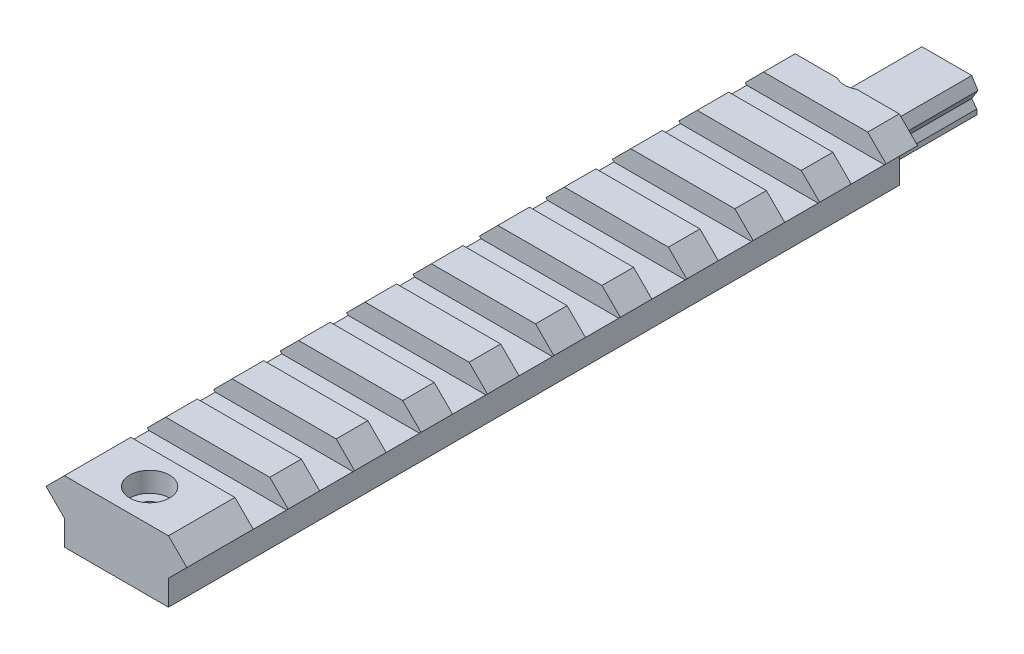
SolidWorks part; units mm, degrees
ref_plane "前视基准面" through (0, 0, 0) normal (0, 0, 1) x (1, 0, 0)
ref_plane "上视基准面" through (0, 0, 0) normal (0, 1, 0) x (1, 0, 0)
ref_plane "右视基准面" through (0, 0, 0) normal (1, 0, 0) x (0, 0, -1)
other "Configuration Table"
sketch "草图2" plane through (0, 0, 0) normal (0, 0, 1) x (1, 0, 0)
  line L0 (-26.0262, 29.9696) -> (-28.7912, 27.2046)
  line L1 (-28.7912, 29.9696) -> (-7.5912, 29.9696)
  line L2 (-28.7912, 29.9696) -> (-28.7912, 20.6496)
  line L3 (-28.7912, 20.6496) -> (-7.5912, 20.6496)
  line L4 (-7.5912, 29.9696) -> (-7.5912, 20.6496)
  line L5 (-28.7912, 29.9696) -> (-7.5912, 20.6496) construction
  line L6 (-28.7912, 20.6496) -> (-7.5912, 29.9696) construction
  line L7 (-26.0262, 20.6496) -> (-10.3562, 20.6496)
  line L8 (-26.0262, 20.6496) -> (-26.0262, 29.9696)
  line L9 (-26.0262, 29.9696) -> (-10.3562, 29.9696)
  line L10 (-10.3562, 20.6496) -> (-10.3562, 29.9696)
  line L11 (-26.0262, 20.6496) -> (-10.3562, 29.9696) construction
  line L12 (-26.0262, 29.9696) -> (-10.3562, 20.6496) construction
  line L13 (-28.7912, 27.2046) -> (-26.0262, 24.4396)
  line L14 (-18.1912, 29.9696) -> (-18.1912, 20.6496) construction
  line L15 (-7.5912, 27.2046) -> (-10.3562, 24.4396)
  line L16 (-10.3562, 29.9696) -> (-7.5912, 27.2046)
  point P0 (-18.1912, 25.3096)
  point P5 (-18.1912, 25.3096)
  dimension "D1" = 9.32
  dimension "D2" = 21.2
  dimension "D3" = 9.32
  dimension "D4" = 15.67
  dimension "D5" = 45
  dimension "D6" = 45
extrude "凸台-拉伸1" add sketch "草图2" along normal blind 110 contours L0 L13 L8 | L3 L10 L1 L8 | L16 L10 L15
sketch "草图3" plane through (0, 29.9696, 0) normal (0, 1, 0) x (1, 0, 0)
  line L1 (-28.7912, -4.75) -> (-7.5912, -4.75)
  line L2 (-28.7912, -4.75) -> (-28.7912, -10)
  line L3 (-28.7912, -10) -> (-7.5912, -10)
  line L4 (-7.5912, -4.75) -> (-7.5912, -10)
  line L6 (-28.7912, -14.75) -> (-28.7912, -20)
  line L7 (-26.0262, 0) -> (-10.3562, 0) construction
  line L8 (-28.7912, -14.75) -> (-7.5912, -14.75)
  line L9 (-7.5912, -14.75) -> (-7.5912, -20)
  line L10 (-28.7912, -20) -> (-7.5912, -20)
  line L11 (-28.7912, -24.75) -> (-28.7912, -30)
  line L12 (-28.7912, -24.75) -> (-7.5912, -24.75)
  line L13 (-7.5912, -24.75) -> (-7.5912, -30)
  line L14 (-28.7912, -30) -> (-7.5912, -30)
  line L15 (-28.7912, -34.75) -> (-28.7912, -40)
  line L16 (-28.7912, -34.75) -> (-7.5912, -34.75)
  line L17 (-7.5912, -34.75) -> (-7.5912, -40)
  line L18 (-28.7912, -40) -> (-7.5912, -40)
  line L19 (-28.7912, -44.75) -> (-28.7912, -50)
  line L20 (-28.7912, -44.75) -> (-7.5912, -44.75)
  line L21 (-7.5912, -44.75) -> (-7.5912, -50)
  line L22 (-28.7912, -50) -> (-7.5912, -50)
  line L23 (-28.7912, -54.75) -> (-28.7912, -60)
  line L24 (-28.7912, -54.75) -> (-7.5912, -54.75)
  line L25 (-7.5912, -54.75) -> (-7.5912, -60)
  line L26 (-28.7912, -60) -> (-7.5912, -60)
  line L27 (-28.7912, -64.75) -> (-28.7912, -70)
  line L28 (-28.7912, -64.75) -> (-7.5912, -64.75)
  line L29 (-7.5912, -64.75) -> (-7.5912, -70)
  line L30 (-28.7912, -70) -> (-7.5912, -70)
  line L31 (-28.7912, -74.75) -> (-28.7912, -80)
  line L32 (-28.7912, -74.75) -> (-7.5912, -74.75)
  line L33 (-7.5912, -74.75) -> (-7.5912, -80)
  line L34 (-28.7912, -80) -> (-7.5912, -80)
  line L35 (-28.7912, -84.75) -> (-28.7912, -90)
  line L36 (-28.7912, -84.75) -> (-7.5912, -84.75)
  line L37 (-7.5912, -84.75) -> (-7.5912, -90)
  line L38 (-28.7912, -90) -> (-7.5912, -90)
  line L39 (-28.7912, -94.75) -> (-28.7912, -100)
  line L40 (-28.7912, -94.75) -> (-7.5912, -94.75)
  line L41 (-7.5912, -94.75) -> (-7.5912, -100)
  line L42 (-28.7912, -100) -> (-7.5912, -100)
  line L43 (-18.1912, 0) -> (-18.1912, -22.7265) construction
  point P6 (-18.1912, -4.75)
  dimension "D1" = 5.25
  dimension "D2" = 10
  dimension "D4" = 21.2
  dimension "D3" = 10
extrude "切除-拉伸1" cut sketch "草图3" against normal blind 3
sketch "草图4" plane through (0, 29.9696, 0) normal (0, 1, 0) x (1, 0, 0)
  line L0 (-18.1912, -100) -> (-18.1912, -110) construction
  line L1 (-28.5562, -100) -> (-7.8262, -100) construction
  line L2 (-26.0262, -110) -> (-10.3562, -110) construction
  circle A0 centre (-18.1912, -105) radius 3
  dimension "D1" = 6
extrude "切除-拉伸2" cut sketch "草图4" against normal blind 3
sketch "草图5" plane through (0, 26.9696, 0) normal (0, 1, 0) x (1, 0, 0)
  circle A0 centre (-18.1912, -105) radius 1.5
  dimension "D1" = 3
extrude "切除-拉伸3" cut sketch "草图5" against normal through all
sketch "草图8" plane through (0, 0, 0) normal (0, 0, -1) x (-1, 0, 0)
  line L0 (7.5912, 27.2046) -> (28.7912, 27.2046) construction
  line L1 (18.1912, 27.2046) -> (18.1912, 20.6496) construction
  line L2 (26.0262, 20.6496) -> (10.3562, 20.6496) construction
  line L3 (22.6912, 20.6476) -> (22.6912, 21.4251)
  line L4 (22.6912, 21.4251) -> (21.9415, 22.4252)
  line L5 (21.9415, 22.4252) -> (22.8782, 23.9252)
  line L6 (22.8782, 23.9252) -> (21.9412, 25.4254)
  line L7 (21.9412, 25.4254) -> (14.4412, 25.4287)
  line L8 (14.4412, 25.4287) -> (13.5039, 23.9291)
  line L9 (13.5039, 23.9291) -> (14.4415, 22.4261)
  line L10 (14.4415, 22.4261) -> (13.6916, 21.429)
  line L11 (13.6916, 21.429) -> (13.6912, 20.6515)
  line L12 (13.6912, 20.6515) -> (22.6912, 20.6476)
  line L13 (18.1912, 25.4271) -> (18.1912, 20.6496) construction
  dimension "D1" = 4.7775
  dimension "D2" = 7.5
  dimension "D3" = 9.3743
  dimension "D4" = 7.5
  dimension "D5" = 116.034
  dimension "D6" = 116.029
extrude "凸台-拉伸2" add sketch "草图8" along normal blind 15
sketch "草图9" plane through (0, 0, 0) normal (0, 0, -1) x (-1, 0, 0)
  line L0 (10.3562, 22.5446) -> (12.3562, 22.5446) construction
  line L1 (10.3562, 20.6496) -> (10.3562, 24.4396) construction
  line L2 (26.0262, 22.5446) -> (24.0262, 22.5446) construction
  line L3 (26.0262, 20.6496) -> (26.0262, 24.4396) construction
  circle A0 centre (12.3562, 22.5446) radius 1
  circle A1 centre (24.0262, 22.5446) radius 1
  dimension "D3" = 2
  dimension "D4" = 2
  dimension "D1" = 2
  dimension "D2" = 2
extrude "切除-拉伸6" cut sketch "草图9" against normal blind 5
sketch "草图10" plane through (-0.0112, 25.435, 0) normal (-0.0004, 1, 0) x (1, 0.0004, 0)
  circle A0 centre (-18.1801, 2.625) radius 3
  ellipse E0 centre (-18.1801, 2.625) end of major axis (-18.1801, -0.375) minor radius 3 (-16.7277, 0) -> (-19.6325, 0) ccw construction
  ellipse E1 centre (-18.1801, 2.625) end of major axis (-18.1801, -0.375) minor radius 3 (-16.7277, 0) -> (-19.6325, 0) ccw construction
  dimension "D1" = 6
extrude "切除-拉伸7" cut sketch "草图10" along normal through all
sketch "草图11" plane through (-0.0112, 25.435, 0) normal (-0.0004, 1, 0) x (1, 0.0004, 0)
  circle A0 centre (-18.1801, 2.625) radius 1.5
  dimension "D1" = 3
extrude "切除-拉伸8" cut sketch "草图11" against normal through all
